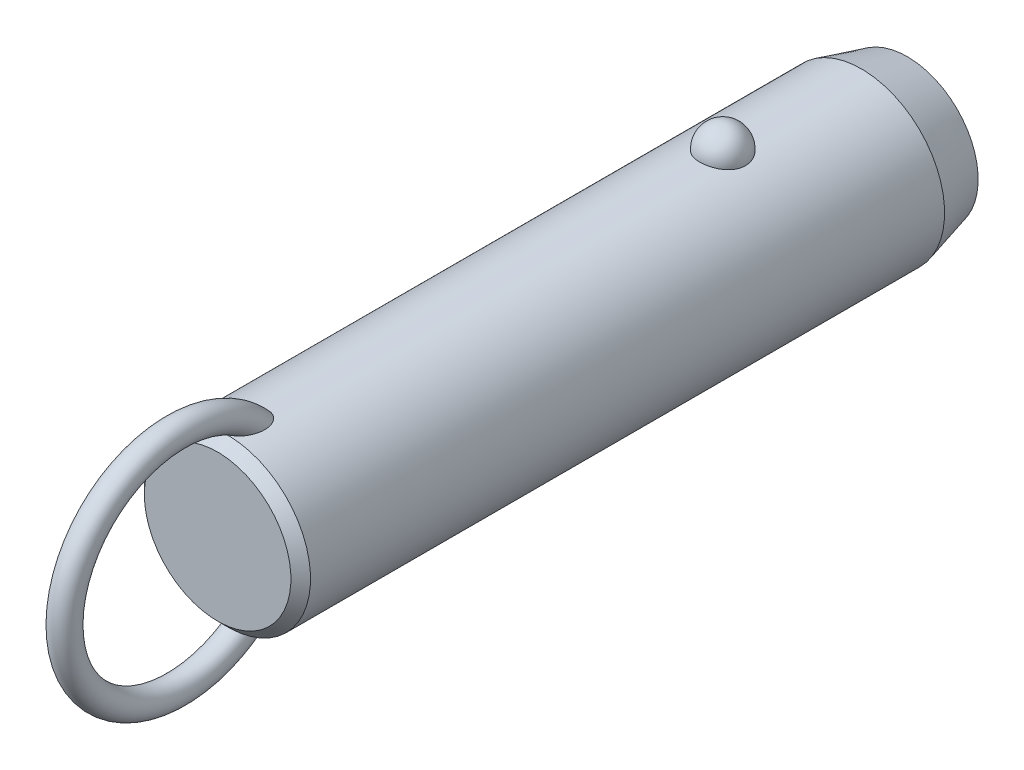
SolidWorks part; units mm, degrees
ref_plane "Front Plane" through (0, 0, 0) normal (0, 0, 1) x (1, 0, 0)
ref_plane "Top Plane" through (0, 0, 0) normal (0, 1, 0) x (1, 0, 0)
ref_plane "Right Plane" through (0, 0, 0) normal (1, 0, 0) x (0, 0, -1)
sketch "Sketch2" plane through (0, 0, 0) normal (0, 0, 1) x (1, 0, 0)
  circle A0 centre (0, 0) radius 12.7
  point P3 (0, 12.7)
  dimension "D1" = 25.4
extrude "Boss-Extrude1" add sketch "Sketch2" along normal blind 61
sketch "Sketch3" plane through (0, 0, 0) normal (0, 0, -1) x (-1, 0, 0)
  circle A0 centre (0, 0) radius 12.7
  dimension "D1" = 25.4
extrude "Boss-Extrude2" add sketch "Sketch3" along normal blind 31.7
chamfer "Chamfer1" distance 7 angle 15 1 edges at (-12.7, 0, -31.7)
sketch "Sketch12" plane through (0, 0, 0) normal (1, 0, 0) x (0, 0, -1)
  line L0 (-61, 12.7) -> (-61, -12.7) construction
  point P0 (-61, 0)
sketch "Sketch13" plane through (0, 0, 0) normal (1, 0, 0) x (0, 0, -1)
  circle A0 centre (-80.05, 0) radius 19.05
  point P2 (-61, 0)
  dimension "D1" = 38.1
sketch "Sketch14" plane through (0, 0, 0) normal (0, 1, 0) x (1, 0, 0)
  circle A0 centre (0, -63) radius 2
  point P2 (0, -61)
  dimension "D1" = 4
sweep "Sweep1" add profiles "Sketch14" path "Sketch13"
sketch "Sketch15" plane through (0, 0, 61) normal (0, 0, 1) x (1, 0, 0)
  circle A0 centre (0, 0) radius 12.7
  dimension "D1" = 25.4
extrude "Boss-Extrude3" add sketch "Sketch15" along normal blind 12.7
chamfer "Chamfer2" distance 1.5 angle 45 1 edges at (12.7, 0, 73.7)
sketch "Sketch18" plane through (0, 0, 0) normal (1, 0, 0) x (0, 0, -1)
  line L0 (24.7, 12.7) -> (-65.851, 12.7) construction
  line L1 (3.5, 16.2) -> (3.5, 9.2)
  line L2 (-65.851, -12.7) -> (24.7, -12.7) construction
  arc A0 (3.5, 16.2) -> (3.5, 9.2) centre (3.5, 12.7) ccw
  point P4 (0, 12.7)
  dimension "D1" = 28.9
revolve "Revolve1" add sketch "Sketch18" angle 360 about L1
